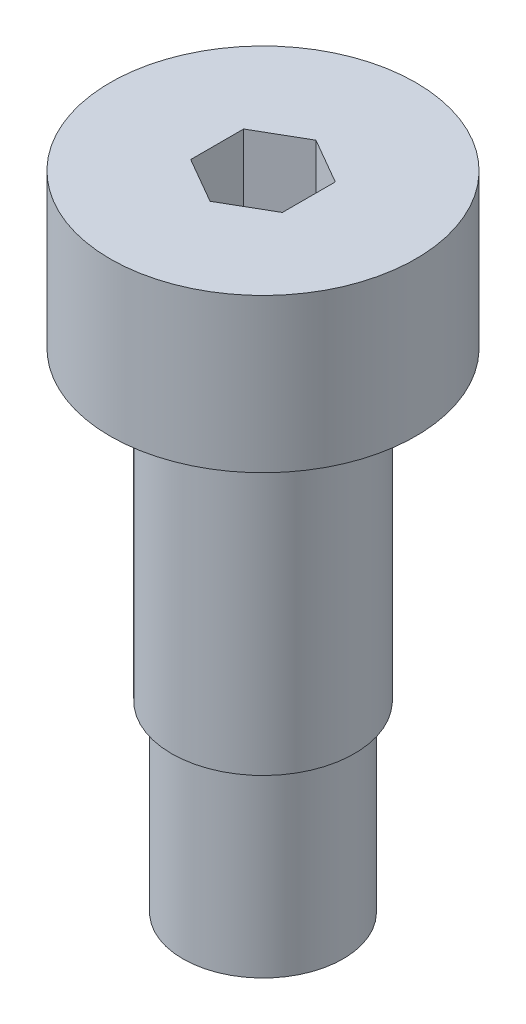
SolidWorks part; units mm, degrees
ref_plane "Front" through (0, 0, 0) normal (0, 0, 1) x (1, 0, 0)
ref_plane "Top" through (0, 0, 0) normal (0, 1, 0) x (1, 0, 0)
ref_plane "Right" through (0, 0, 0) normal (1, 0, 0) x (0, 0, -1)
sketch "Sketch1" plane through (0, 0, 0) normal (0, 0, 1) x (1, 0, 0)
  line L0 (0, 49.1435) -> (0, -61.5122) construction
  line L1 (0, 3.9878) -> (3.9688, 3.9878)
  line L2 (3.9688, 3.9878) -> (3.9688, 0)
  line L3 (3.9688, 0) -> (2.3749, 0)
  line L4 (2.3749, 0) -> (2.3749, -7.9375)
  line L5 (2.3749, -7.9375) -> (2.0828, -7.9375)
  line L6 (2.0828, -7.9375) -> (2.0828, -12.7)
  line L7 (2.0828, -12.7) -> (0, -12.7)
  line L8 (0, -12.7) -> (0, 3.9878)
  dimension "D1" = 4.1656
  dimension "D2" = 4.7498
  dimension "D3" = 7.9375
  dimension "D4" = 3.9878
  dimension "D5" = 7.9375
  dimension "D6" = 4.7625
revolve "Revolve1" add sketch "Sketch1" angle 360 about L0
sketch "Sketch2" plane through (0, 3.9878, 0) normal (0, 1, 0) x (-1, 0, 0)
  line L1 (0, 1.3748) -> (-1.1906, 0.6874)
  line L2 (-1.1906, 0.6874) -> (-1.1906, -0.6874)
  line L3 (-1.1906, -0.6874) -> (0, -1.3748)
  line L4 (0, -1.3748) -> (1.1906, -0.6874)
  line L5 (1.1906, -0.6874) -> (1.1906, 0.6874)
  line L6 (1.1906, 0.6874) -> (0, 1.3748)
  circle A0 centre (0, 0) radius 1.1906 construction
  dimension "D1" = 2.3813
extrude "Cut-Extrude1" cut sketch "Sketch2" against normal blind 2.3812
